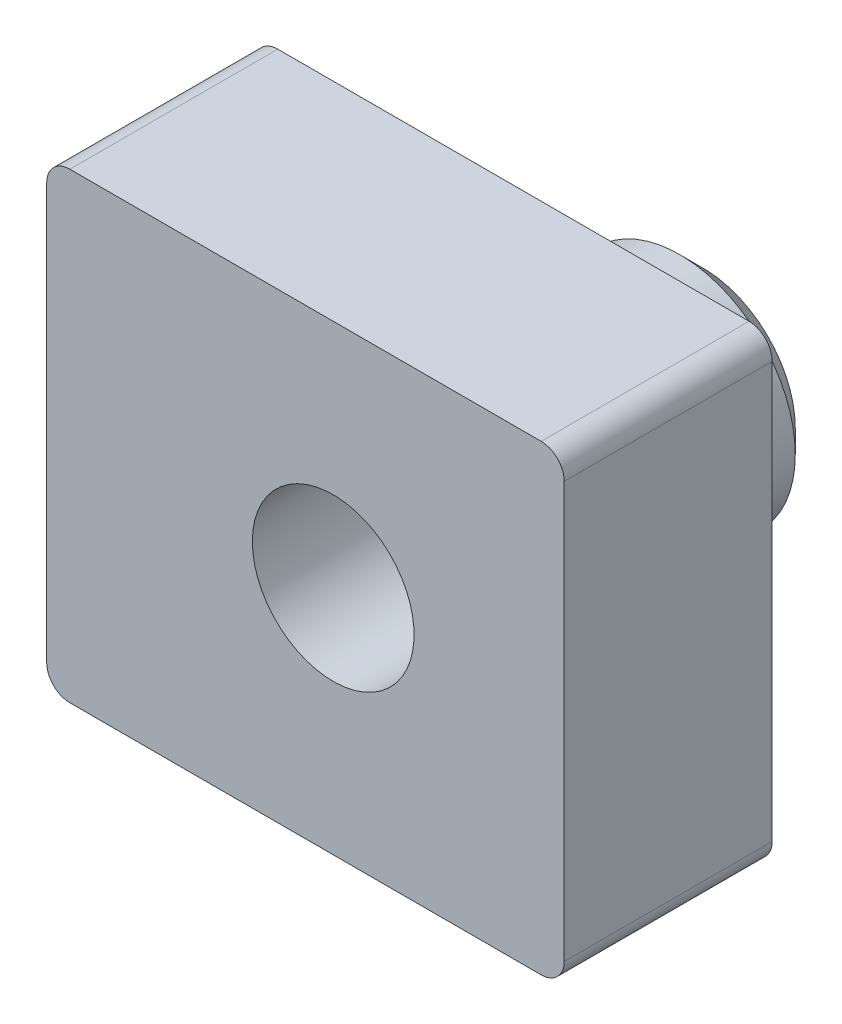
SolidWorks part; units mm, degrees
ref_plane "Přední" through (0, 0, 0) normal (0, 0, 1) x (1, 0, 0)
ref_plane "Horní" through (0, 0, 0) normal (0, 1, 0) x (1, 0, 0)
ref_plane "Pravá" through (0, 0, 0) normal (1, 0, 0) x (0, 0, -1)
sketch "Skica2" plane through (0, 0, 0) normal (0, 0, 1) x (1, 0, 0)
  circle A0 centre (10, 0) radius 2.5 construction
  circle A1 centre (10, 0) radius 2.5
extrude "Základ-Protažení" add sketch "Skica2" against normal blind 3
sketch "Skica3" plane through (0, 0, 0) normal (0, 0, 1) x (1, 0, 0)
  line L2 (8.1157, -3.5) -> (11.8843, -3.5)
  line L3 (11.8843, 3.5) -> (8.1157, 3.5)
  line L4 (8.1157, -3.5) -> (11.8843, -3.5)
  line L5 (11.8843, 3.5) -> (8.1157, 3.5)
  arc A2 (11.8843, -3.5) -> (11.8843, 3.5) centre (10, 0) ccw
  arc A3 (8.1157, 3.5) -> (8.1157, -3.5) centre (10, 0) ccw
  arc A4 (11.8843, -3.5) -> (11.8843, 3.5) centre (10, 0) ccw
  arc A5 (8.1157, 3.5) -> (8.1157, -3.5) centre (10, 0) ccw
  dimension "D1" = 0
extrude "Přidání-Protažení1" add sketch "Skica3" along normal blind 0.5
sketch "Skica4" plane through (0, 0, 0.5) normal (0, 0, 1) x (1, 0, 0)
  line L0 (3.8, -0.9159) -> (3.8, 0.9159) construction
  line L1 (15, 5) -> (4.248, 5) construction
  line L2 (4.248, -5) -> (15, -5) construction
  line L3 (15, -5) -> (15, 5) construction
  line L4 (3.8, -4.5) -> (3.8, 4.5)
  line L5 (14.5, 5) -> (4.3, 5)
  line L6 (4.3, -5) -> (14.5, -5)
  line L7 (15, -4.5) -> (15, 4.5)
  arc A0 (14.5, -5) -> (15, -4.5) centre (14.5, -4.5) ccw
  arc A1 (3.8, -4.5) -> (4.3, -5) centre (4.3, -4.5) ccw
  arc A2 (4.3, 5) -> (3.8, 4.5) centre (4.3, 4.5) ccw
  arc A3 (15, 4.5) -> (14.5, 5) centre (14.5, 4.5) ccw
  dimension "D1" = 0.5
extrude "Přidání-Protažení2" add sketch "Skica4" along normal blind 4.5
chamfer "Zkosení1" distance 0.5 angle 45 1 edges at (12.5, 0, -3)
sketch "Skica5" plane through (0, 0, -3) normal (0, 0, -1) x (-1, 0, 0)
  circle A0 centre (-10, 0) radius 1.75
  dimension "D1" = 3.5
extrude "Odebrání-Protažení1" cut sketch "Skica5" against normal through all
